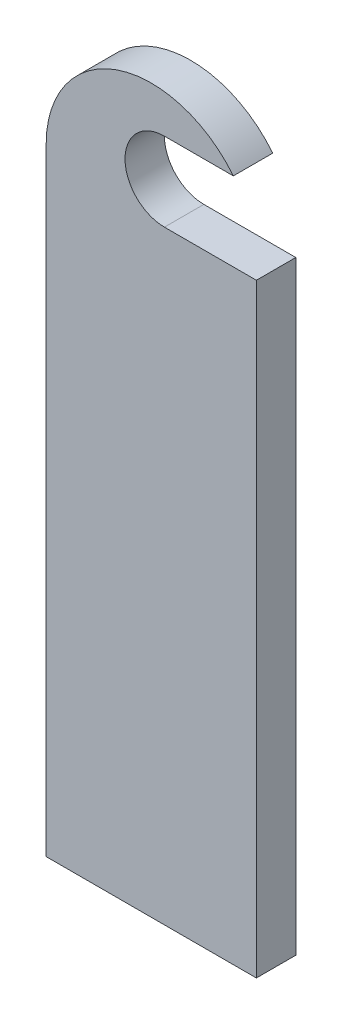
SolidWorks part; units mm, degrees
ref_plane "Plan de face" through (0, 0, 0) normal (0, 0, 1) x (1, 0, 0)
ref_plane "Plan de dessus" through (0, 0, 0) normal (0, 1, 0) x (1, 0, 0)
ref_plane "Plan de droite" through (0, 0, 0) normal (1, 0, 0) x (0, 0, -1)
sketch "Esquisse1" plane through (0, 0, 0) normal (0, 0, 1) x (1, 0, 0)
  line L0 (-8, 0) -> (8, 0)
  line L1 (8, 0) -> (8, 46)
  line L2 (-8, 47) -> (-8, 0)
  line L3 (0, -6.7293) -> (0, 78.1204) construction
  line L4 (8, 46) -> (1, 46)
  line L5 (1, 52) -> (6.245, 52)
  arc A0 (6.245, 52) -> (-8, 47) centre (0, 47) ccw
  arc A1 (1, 46) -> (1, 52) centre (1, 49) cw
  point P4 (-2, 49)
  dimension "D1" = 55
  dimension "D4" = 6
  dimension "D5" = 49
  dimension "D2" = 16
  dimension "D3" = 6
extrude "Boss.-Extru.1" add sketch "Esquisse1" along normal blind 3
